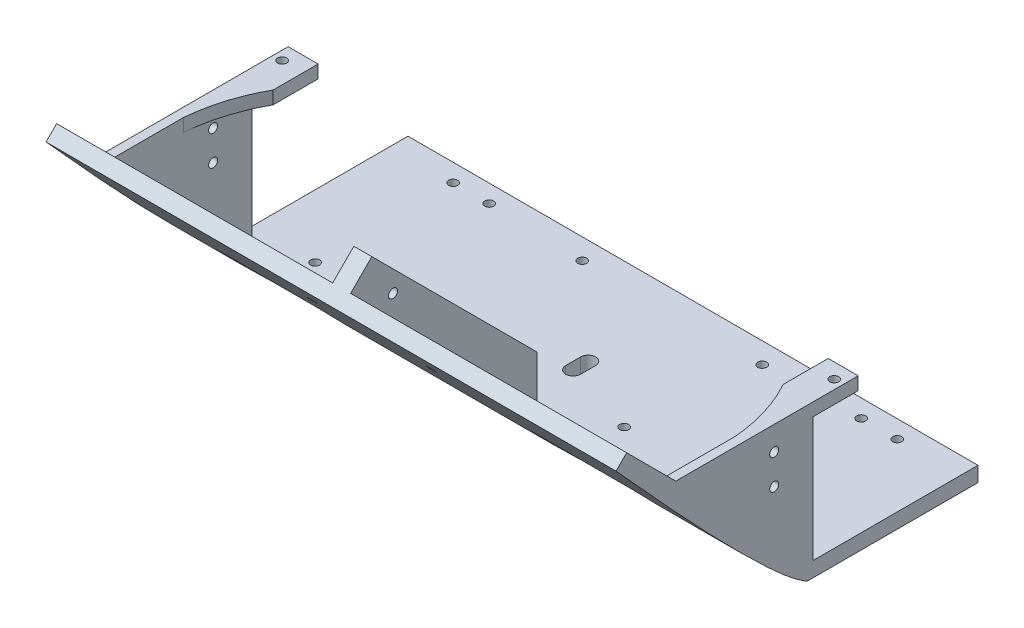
SolidWorks part; units mm, degrees
ref_plane "前视基准面" through (0, 0, 0) normal (0, 0, 1) x (1, 0, 0)
ref_plane "上视基准面" through (0, 0, 0) normal (0, 1, 0) x (1, 0, 0)
ref_plane "右视基准面" through (0, 0, 0) normal (1, 0, 0) x (0, 0, -1)
sketch "草图1" plane through (0, 0, 0) normal (1, 0, 0) x (0, 0, -1)
  line L0 (0, 0) -> (-45, 0)
  line L2 (-108.6396, 63.6396) -> (-105.1041, 67.1751)
  line L3 (-105.1041, 67.1751) -> (-42.9289, 5)
  line L4 (0, 0) -> (0, 5)
  line L5 (0, 5) -> (-42.9289, 5)
  spline S0 degree 3 poles (-108.6396, 63.6396) (-92.6847, 46.0089) (-70.0896, 21.0269) (-49.5919, 2.8409) (-45, 0) knots 0 0 0 0 0.808693 1 1 1 1
  dimension "D1" = 45
  dimension "D2" = 135
  dimension "D3" = 90
  dimension "D4" = 5
  dimension "D5" = 5
extrude "凸台-拉伸1" add sketch "草图1" along normal blind 190
sketch "草图2" plane through (0, -18.9645, 18.9645) normal (0, 0.7071, -0.7071) x (-1, 0, 0)
  line L0 (-95, 121.8198) -> (-95, 33.8909) construction
  line L1 (-190, 121.8198) -> (0, 121.8198) construction
  line L2 (-190, 33.8909) -> (0, 33.8909) construction
  line L3 (-129.5, 41.5879) -> (-164.5, 76.5879) construction
  line L4 (-60.5, 76.5879) -> (-25.5, 76.5879)
  line L5 (-60.5, 76.5879) -> (-60.5, 41.5879)
  line L6 (-60.5, 41.5879) -> (-25.5, 41.5879)
  line L7 (-25.5, 76.5879) -> (-25.5, 41.5879)
  line L8 (-60.5, 76.5879) -> (-25.5, 41.5879) construction
  line L9 (-60.5, 41.5879) -> (-25.5, 76.5879) construction
  line L10 (-129.5, 76.5879) -> (-164.5, 41.5879) construction
  line L11 (-164.5, 76.5879) -> (-164.5, 41.5879)
  line L12 (-129.5, 41.5879) -> (-164.5, 41.5879)
  line L13 (-129.5, 76.5879) -> (-129.5, 41.5879)
  line L14 (-129.5, 76.5879) -> (-164.5, 76.5879)
  point P6 (-43, 59.0879)
  point P15 (-147, 59.0879)
  dimension "D1" = 35
  dimension "D2" = 35
  dimension "D3" = 52
extrude "切除-拉伸1" cut sketch "草图2" against normal blind 150
sketch "草图3" plane through (0, 0, 0) normal (-1, 0, 0) x (0, 0, 1)
  line L0 (42.9289, 5) -> (42.9289, 50.8)
  line L1 (42.9289, 50.8) -> (88.7289, 50.8)
  line L2 (88.7289, 50.8) -> (42.9289, 5)
  line L3 (0, 5) -> (42.9289, 5) construction
  line L4 (42.9289, 5) -> (105.1041, 67.1751) construction
  dimension "D1" = 45.8
extrude "凸台-拉伸2" add sketch "草图3" against normal blind 3
sketch "草图4" plane through (190, 0, 0) normal (1, 0, 0) x (0, 0, -1)
  line L0 (-42.9289, 5) -> (-42.9289, 50.8)
  line L1 (-42.9289, 50.8) -> (-88.7289, 50.8)
  line L2 (-88.7289, 50.8) -> (-42.9289, 5)
  line L3 (-88.7289, 50.8) -> (-105.1041, 67.1751) construction
extrude "凸台-拉伸3" add sketch "草图4" against normal blind 3
sketch "草图5" plane through (0, 0, 42.9289) normal (0, 0, -1) x (-1, 0, 0)
  line L0 (-95, 5) -> (-95, 67.1751) construction
  line L1 (-187, 5) -> (-3, 5) construction
  line L2 (-190, 67.1751) -> (0, 67.1751) construction
  line L3 (-180, 50.8) -> (-180, 46.5)
  line L4 (0, 50.8) -> (-10, 50.8)
  line L5 (0, 50.8) -> (0, 46.5)
  line L6 (0, 46.5) -> (-10, 46.5)
  line L7 (-10, 50.8) -> (-10, 46.5)
  line L8 (-190, 46.5) -> (-180, 46.5)
  line L9 (-190, 50.8) -> (-190, 46.5)
  line L10 (-190, 50.8) -> (-180, 50.8)
  dimension "D1" = 10
  dimension "D2" = 4.3
extrude "凸台-拉伸4" add sketch "草图5" along normal blind 15
sketch "草图6" plane through (0, 50.8, 0) normal (0, 1, 0) x (1, 0, 0)
  line L0 (95, -105.1041) -> (95, 0) construction
  line L1 (190, -105.1041) -> (0, -105.1041) construction
  line L2 (190, 0) -> (0, 0) construction
  line L3 (180, -42.9289) -> (187, -42.9289)
  line L4 (187, -42.9289) -> (187, -65.8289)
  line L5 (187, -42.9289) -> (187, -88.7289) construction
  line L6 (3, -42.9289) -> (3, -65.8289)
  line L7 (10, -42.9289) -> (3, -42.9289)
  spline S0 degree 2 poles (180, -42.9289) (185.9063, -53.5653) (187, -65.8289) knots 0 0 0 1 1 1
  spline S1 degree 2 poles (10, -42.9289) (4.0937, -53.5653) (3, -65.8289) knots 0 0 0 1 1 1
extrude "凸台-拉伸5" add sketch "草图6" against normal blind 4.3
sketch "草图7" plane through (0, -18.9645, 18.9645) normal (0, 0.7071, -0.7071) x (-1, 0, 0)
  line L0 (-95, 121.8198) -> (-95, 33.8909) construction
  line L1 (-190, 121.8198) -> (0, 121.8198) construction
  line L2 (-187, 33.8909) -> (-3, 33.8909) construction
  line L3 (4.5, 101.6619) -> (-152.614, 101.6619) construction
  line L4 (-3, 98.6619) -> (-188.5, 98.6619) construction
  line L5 (-187, 98.6619) -> (-190, 98.6619) construction
  circle A0 centre (-75, 101.6619) radius 1.5
  circle A1 centre (-115, 101.6619) radius 1.5
  dimension "D1" = 3
  dimension "D2" = 40
  dimension "D3" = 3
extrude "切除-拉伸2" cut sketch "草图7" against normal blind 25
sketch "草图9" plane through (0, -18.9645, 18.9645) normal (0, 0.7071, -0.7071) x (-1, 0, 0)
  line L0 (-95, 121.8198) -> (-95, 33.8909) construction
  line L1 (-190, 121.8198) -> (0, 121.8198) construction
  line L2 (-187, 33.8909) -> (-3, 33.8909) construction
  line L4 (-98, 33.8909) -> (-92, 33.8909)
  line L5 (-98, 33.8909) -> (-98, 121.8198)
  line L6 (-98, 121.8198) -> (-92, 121.8198)
  line L7 (-92, 33.8909) -> (-92, 121.8198)
  line L8 (-98, 33.8909) -> (-92, 121.8198) construction
  line L9 (-98, 121.8198) -> (-92, 33.8909) construction
  point P6 (-95, 77.8553)
  dimension "D1" = 6
extrude "凸台-拉伸6" add sketch "草图9" along normal blind 10
sketch "草图10" plane through (92, 0, 0) normal (-1, 0, 0) x (0, 0, 1)
  line L0 (42.9289, 5) -> (42.9289, 25.75)
  line L1 (42.9289, 46.5) -> (42.9289, 5) construction
  line L2 (42.9289, 25.75) -> (35.6278, 25.75)
  line L3 (35.6278, 25.75) -> (27.5902, 13.1039)
  line L4 (27.5902, 13.1039) -> (28.7772, 5)
  line L5 (0, 5) -> (42.9289, 5) construction
  line L6 (28.7772, 5) -> (42.9289, 5)
extrude "切除-拉伸3" cut sketch "草图10" against normal blind 6
sketch "草图12" plane through (0, 50.8, 0) normal (0, 1, 0) x (1, 0, 0)
  line L0 (10, -27.9289) -> (10, -42.9289) construction
  line L1 (0, -27.9289) -> (10, -27.9289) construction
  line L2 (95, 0) -> (95, -38.1896) construction
  line L3 (190, 0) -> (0, 0) construction
  circle A0 centre (3, -32.9289) radius 1.5
  circle A1 centre (187, -32.9289) radius 1.5
  dimension "D1" = 3
  dimension "D2" = 7
  dimension "D3" = 5
extrude "切除-拉伸5" cut sketch "草图12" against normal blind 10
sketch "草图13" plane through (0, 5, 0) normal (0, 1, 0) x (1, 0, 0)
  line L0 (92, -42.9289) -> (3, -42.9289) construction
  line L1 (0, 0) -> (0, -42.9289) construction
  line L2 (95, 0) -> (95, -42.9289) construction
  line L3 (190, 0) -> (0, 0) construction
  line L4 (98, -42.9289) -> (92, -42.9289) construction
  circle A0 centre (70, -35.9289) radius 1.5
  circle A1 centre (120, -35.9289) radius 1.5
  dimension "D1" = 3
  dimension "D2" = 7
  dimension "D3" = 70
extrude "切除-拉伸6" cut sketch "草图13" against normal blind 10
sketch "草图14" plane through (0, 0, 0) normal (-1, 0, 0) x (0, 0, 1)
  line L0 (88.7289, 50.8) -> (27.9289, 50.8) construction
  line L1 (42.9289, 46.5) -> (42.9289, 5) construction
  circle A0 centre (55.9289, 42.8) radius 1.5
  circle A1 centre (55.9289, 32.8) radius 1.5
  dimension "D1" = 3
  dimension "D2" = 8
  dimension "D3" = 13
  dimension "D4" = 3
  dimension "D5" = 10
extrude "切除-拉伸7" cut sketch "草图14" against normal blind 10
sketch "草图15" plane through (187, 0, 0) normal (-1, 0, 0) x (0, 0, 1)
  line L5 (88.7289, 50.8) -> (65.8289, 50.8)
  line L6 (65.8289, 50.8) -> (65.8289, 46.5)
  line L7 (65.8289, 46.5) -> (42.9289, 46.5)
  line L8 (42.9289, 46.5) -> (42.9289, 5)
  line L9 (42.9289, 5) -> (88.7289, 50.8)
  line L11 (65.8289, 50.8) -> (65.8289, 46.5)
  circle A0 centre (55.9289, 42.8) radius 1.5 construction
  circle A1 centre (55.9289, 42.8) radius 1.5
  circle A2 centre (55.9289, 32.8) radius 1.5 construction
  circle A3 centre (55.9289, 32.8) radius 1.5
  dimension "D1" = 0
extrude "切除-拉伸8" cut sketch "草图15" against normal blind 10 contours A3 | A1
sketch "草图16" plane through (0, 0, 0) normal (0, 0, -1) x (-1, 0, 0)
  line L1 (-190, 5) -> (0, 5)
  line L2 (-190, 5) -> (-190, 0)
  line L3 (-190, 0) -> (0, 0)
  line L4 (0, 5) -> (0, 0)
extrude "凸台-拉伸7" add sketch "草图16" along normal blind 12
sketch "草图11" plane through (0, 5, 0) normal (0, 1, 0) x (1, 0, 0)
  line L0 (95, 0) -> (95, -42.9289) construction
  line L2 (98, -42.9289) -> (92, -42.9289) construction
  line L3 (0, 12) -> (0, -42.9289) construction
  line L4 (0, -88.7289) -> (0, -27.9289) construction
  line L5 (92, -42.9289) -> (3, -42.9289) construction
  circle A0 centre (21, -39.9289) radius 1.5
  circle A1 centre (21, 6.0711) radius 1.5
  circle A2 centre (33, 6.0711) radius 1.5
  circle A3 centre (157, 6.0711) radius 1.5
  circle A4 centre (169, 6.0711) radius 1.5
  circle A5 centre (169, -39.9289) radius 1.5
  dimension "D1" = 3
  dimension "D2" = 3
  dimension "D3" = 21
  dimension "D4" = 21
  dimension "D5" = 3
  dimension "D6" = 46
  dimension "D7" = 3
  dimension "D8" = 12
extrude "切除-拉伸9" cut sketch "草图11" against normal blind 10
sketch "草图17" plane through (0, 5, 0) normal (0, 1, 0) x (1, 0, 0)
  line L0 (95, -42.9289) -> (95, 12) construction
  line L1 (98, -42.9289) -> (92, -42.9289) construction
  line L2 (0, 12) -> (190, 12) construction
  line L3 (0, 12) -> (0, -42.9289) construction
  line L4 (92, -42.9289) -> (3, -42.9289) construction
  circle A0 centre (65, 5.0711) radius 1.5
  circle A1 centre (125, 5.0711) radius 1.5
  dimension "D1" = 3
  dimension "D2" = 48
  dimension "D3" = 65
extrude "切除-拉伸10" cut sketch "草图17" against normal blind 10
sketch "草图18" plane through (0, 5, 0) normal (0, 1, 0) x (1, 0, 0)
  line L0 (95, 12) -> (95, -42.9289) construction
  line L1 (0, 12) -> (190, 12) construction
  line L2 (98, -42.9289) -> (92, -42.9289) construction
  line L3 (95, -22.9289) -> (95, -27.9289) construction
  line L4 (97.5, -22.9289) -> (97.5, -27.9289)
  line L5 (92.5, -22.9289) -> (92.5, -27.9289)
  line L6 (187, -42.9289) -> (98, -42.9289) construction
  arc A0 (97.5, -22.9289) -> (92.5, -22.9289) centre (95, -22.9289) ccw
  arc A1 (92.5, -27.9289) -> (97.5, -27.9289) centre (95, -27.9289) ccw
  point P8 (95, -25.4289)
  dimension "D2" = 2.5
  dimension "D3" = 15
  dimension "D1" = 5
extrude "切除-拉伸11" cut sketch "草图18" against normal blind 10
sketch "草图19" plane through (92, 0, 0) normal (-1, 0, 0) x (0, 0, 1)
  line L0 (87.4264, 63.6396) -> (94.4975, 56.5685) construction
  line L1 (42.9289, 19.1421) -> (98.033, 74.2462) construction
  line L2 (42.9289, 5) -> (105.1041, 67.1751) construction
  line L3 (98.033, 74.2462) -> (105.1041, 67.1751) construction
  circle A0 centre (90.9619, 60.1041) radius 1.5
  dimension "D2" = 3
  dimension "D1" = 15
extrude "切除-拉伸12" cut sketch "草图19" against normal blind 10
